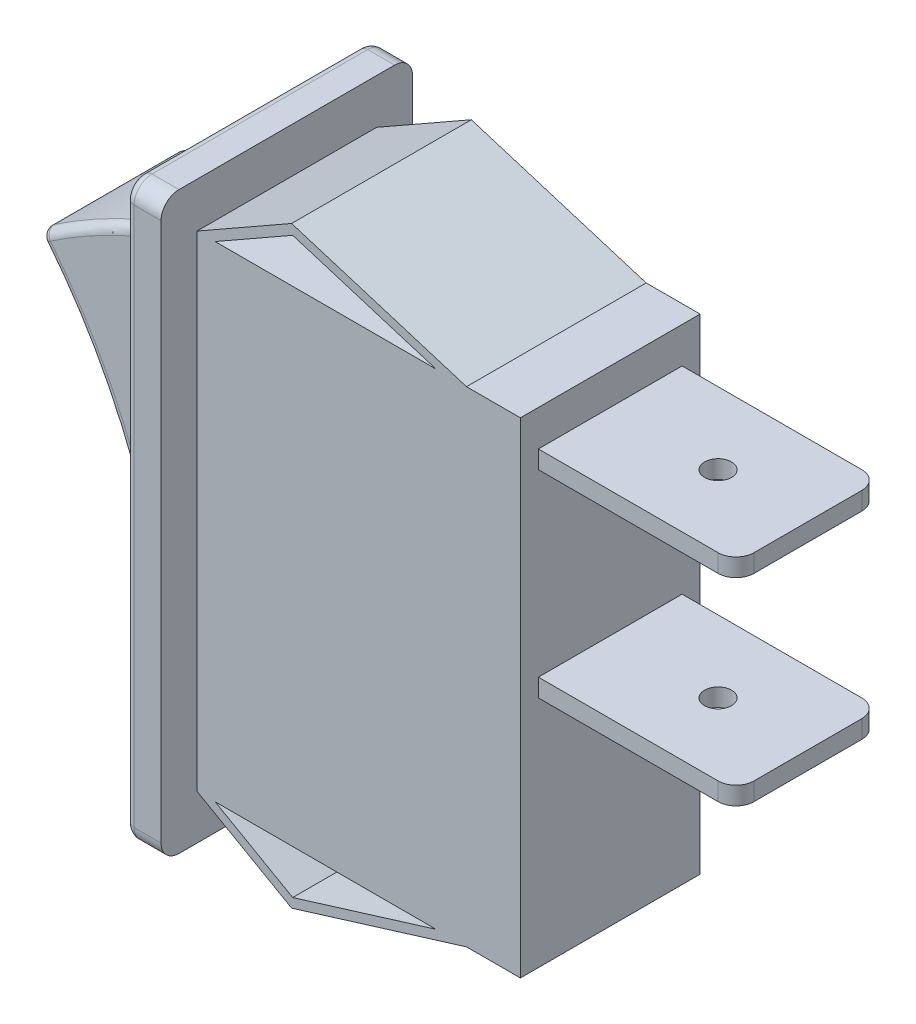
SolidWorks part; units mm, degrees
ref_plane "Face" through (0, 0, 0) normal (0, 0, 1) x (1, 0, 0)
ref_plane "Dessus" through (0, 0, 0) normal (0, 1, 0) x (1, 0, 0)
ref_plane "Droite" through (0, 0, 0) normal (1, 0, 0) x (0, 0, -1)
sketch "Esquisse1" plane through (0, 0, 0) normal (0, 0, 1) x (1, 0, 0)
  line L0 (-3, 13.5) -> (-12.7327, 16.5)
  line L1 (-16.9897, 13.5) -> (-4.6974, 13.5)
  line L2 (-18, 13.5) -> (-18, -13.5)
  line L3 (-16.9897, -13.5) -> (-4.6974, -13.5)
  line L4 (0, 13.5) -> (0, -13.5)
  line L5 (-12.7327, 16.5) -> (-18, 13.5)
  line L6 (-16.9897, 13.5) -> (-12.6733, 15.9585)
  line L7 (-12.6733, 15.9585) -> (-4.6974, 13.5)
  line L8 (-3, 13.5) -> (0, 13.5)
  line L9 (-18, -13.5) -> (-12.7327, -16.5)
  line L10 (-12.7327, -16.5) -> (-3, -13.5)
  line L11 (-4.6974, -13.5) -> (-12.6733, -15.9585)
  line L12 (-12.6733, -15.9585) -> (-16.9897, -13.5)
  line L13 (-3, -13.5) -> (0, -13.5)
  dimension "D1" = 18
  dimension "D2" = 3
  dimension "D3" = 27
  dimension "D4" = 0.5
  dimension "D5" = 0.5
  dimension "D6" = 3
  dimension "D7" = 3
  dimension "D8" = 0.5
  dimension "D9" = 0.5
extrude "Extrusion1" add sketch "Esquisse1" along normal mid plane 10
sketch "Esquisse2" plane through (-18, 0, 0) normal (-1, 0, 0) x (0, 0, 1)
  line L1 (6, 16) -> (-6, 16)
  line L2 (7, 15) -> (7, -15)
  line L3 (6, -16) -> (-6, -16)
  line L4 (-7, 15) -> (-7, -15)
  arc A0 (-7, 15) -> (-6, 16) centre (-6, 15) cw
  arc A1 (7, 15) -> (6, 16) centre (6, 15) ccw
  arc A2 (-6, -16) -> (-7, -15) centre (-6, -15) cw
  arc A3 (7, -15) -> (6, -16) centre (6, -15) cw
  dimension "D5" = 1
  dimension "D1" = 14
  dimension "D2" = 7
  dimension "D3" = 32
  dimension "D4" = 16
extrude "Extrusion2" add sketch "Esquisse2" along normal blind 2
fillet "Congé1" radius 0.5
sketch "Esquisse3" plane through (0, 0, 0) normal (0, 0, 1) x (1, 0, 0)
  line L0 (-11.0539, 11.5) -> (11, 11.5)
  line L1 (11, 11.5) -> (11, 10.5)
  line L2 (11, 10.5) -> (-3, 10.5)
  line L3 (-3, 10.5) -> (-3, 0.5)
  line L4 (-3, 0.5) -> (11, 0.5)
  line L5 (11, 0.5) -> (11, -0.5)
  line L6 (11, -0.5) -> (-2.9657, -0.5)
  line L7 (-2.9657, -0.5) -> (-19.1216, -12.44)
  line L8 (-19.1216, -12.44) -> (-21.031, -12.44)
  line L9 (-11.0539, 11.5) -> (-18.0854, 12.5595)
  line L10 (0, 13.5) -> (-3, 13.5) construction
  line L11 (0, -13.5) -> (0, 13.5) construction
  line L13 (-20, -15) -> (-20, 15) construction
  line L14 (-19.5, 16) -> (-18, 16) construction
  line L15 (-18, -15) -> (-18, 15) construction
  arc A1 (-21.031, -12.44) -> (-27.8834, 8.044) centre (-51, -11.0772) ccw
  arc A2 (-18.0854, 12.5595) -> (-27.8834, 8.044) centre (-10.6325, -16.5) ccw
  point P9 (-20, 12)
  dimension "D1" = 30
  dimension "D6" = 16
  dimension "D7" = 30
  dimension "D2" = 1
  dimension "D3" = 11
  dimension "D4" = 2
  dimension "D5" = 11
  dimension "D8" = 4
  dimension "D9" = 51
  dimension "D10" = 15
extrude "Extrusion4" add sketch "Esquisse3" along normal mid plane 8
fillet "Congé2" radius 0.5
fillet "Congé3" radius 1
sketch "Esquisse4" plane through (0, 11.5, 0) normal (0, 1, 0) x (-1, 0, 0)
  circle A0 centre (-6, 0) radius 0.75
  dimension "D1" = 1.5
  dimension "D2" = 6
extrude "Enlèv. mat.-Extru.1" cut sketch "Esquisse4" against normal through all
ref_plane "Plan1" through (-21, 0, 0) normal (1, 0, 0) x (0, 0, -1)
sketch "Esquisse5" plane through (-21, 0, 0) normal (1, 0, 0) x (0, 0, -1)
  line L1 (-0.5, -7) -> (0.5, -7)
  line L2 (-0.5, -7) -> (-0.5, -11)
  line L3 (-0.5, -11) -> (0.5, -11)
  line L4 (0.5, -7) -> (0.5, -11)
  dimension "D1" = 1
  dimension "D2" = 0.5
  dimension "D3" = 4
  dimension "D4" = 7
extrude "Enlèv. mat.-Extru.2" cut sketch "Esquisse5" against normal blind 0.5
ref_plane "Plan2" through (-21.5532, -12.4437, 0) normal (-0.866, -0.5, 0) x (0.5, -0.866, 0)
ref_plane "Plan3" through (-17.2231, -9.9437, 0) normal (-0.866, -0.5, 0) x (0, 0, 1)
sketch "Esquisse6" plane through (-17.2231, -9.9437, 0) normal (-0.866, -0.5, 0) x (0, 0, 1)
  circle A0 centre (0, 17.5857) radius 2.25
  circle A1 centre (0, 17.5857) radius 1.25
  dimension "D1" = 4.5
  dimension "D2" = 2.5
extrude "Enlèv. mat.-Extru.3" cut sketch "Esquisse6" against normal mid plane 0.5
